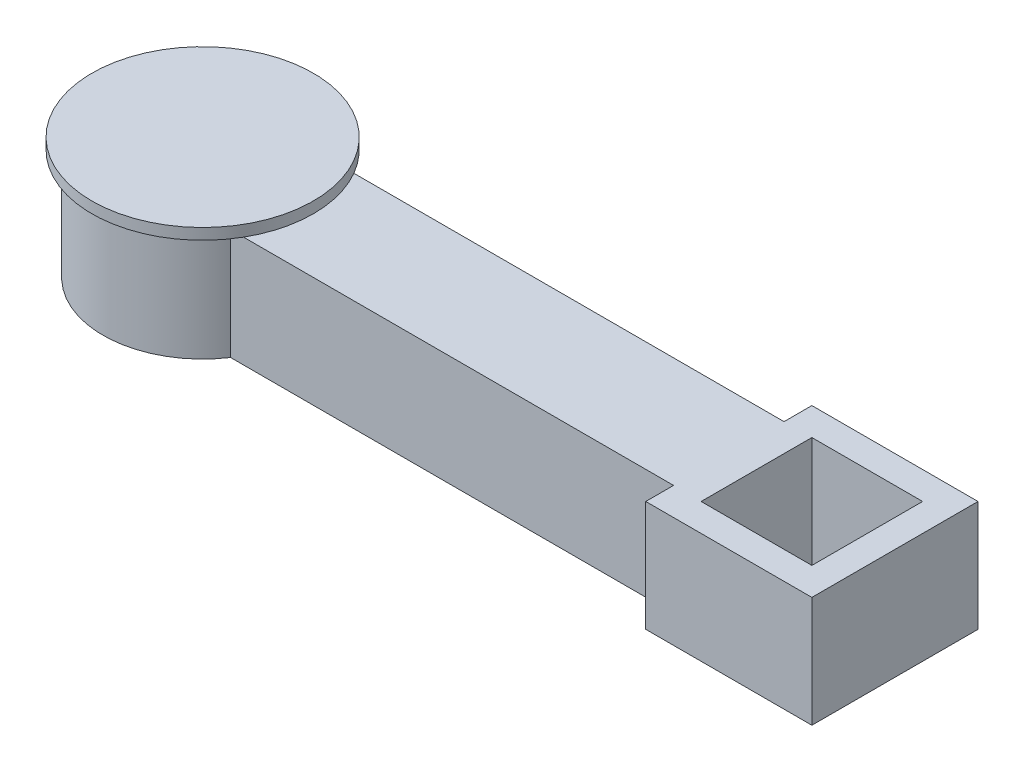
SolidWorks part; units mm, degrees
ref_plane "Front Plane" through (0, 0, 0) normal (0, 0, 1) x (1, 0, 0)
ref_plane "Top Plane" through (0, 0, 0) normal (0, 1, 0) x (1, 0, 0)
ref_plane "Right Plane" through (0, 0, 0) normal (1, 0, 0) x (0, 0, -1)
sketch "Sketch1" plane through (0, 0, 0) normal (0, 1, 0) x (1, 0, 0)
  line L0 (163.1456, 275.7418) -> (163.1456, 275.9924)
  line L1 (163.1456, 175.9924) -> (563.1456, 175.9924)
  line L2 (163.1456, 175.9924) -> (163.1456, 176.2431)
  line L3 (163.1456, 275.9924) -> (563.1456, 275.9924)
  line L4 (563.1456, 175.9924) -> (563.1456, 176.2431)
  line L5 (563.1456, 275.7418) -> (563.1456, 275.9924)
  line L8 (163.1456, 275.9924) -> (563.1456, 275.9924)
  line L9 (163.1456, 275.9924) -> (163.1456, 275.7418)
  line L10 (163.1456, 176.2431) -> (563.1456, 176.2431)
  line L11 (563.1456, 275.9924) -> (563.1456, 176.2431)
  line L12 (563.1456, 301.1178) -> (713.1456, 301.1178)
  line L13 (563.1456, 301.1178) -> (563.1456, 151.1178)
  line L14 (563.1456, 151.1178) -> (713.1456, 151.1178)
  line L15 (713.1456, 301.1178) -> (713.1456, 151.1178)
  arc A0 (163.1456, 275.7418) -> (163.1456, 176.2431) centre (88.1456, 225.9924) ccw
  point P13 (713.1456, 226.1178)
  point P14 (563.1456, 226.1178)
  dimension "D3" = 180
  dimension "D6" = 150
  dimension "D1" = 400
  dimension "D2" = 100
  dimension "D4" = 50
  dimension "D5" = 75
  dimension "D7" = 150
extrude "Boss-Extrude1" add sketch "Sketch1" along normal blind 100 contours L0 A0 L10 L11 L5 L3 | L13 L12 L15 L14
sketch "Sketch5" plane through (0, 100, 0) normal (0, 1, 0) x (1, 0, 0)
  circle A0 centre (88.1456, 225.9924) radius 70
  dimension "D1" = 140
extrude "Cut-Extrude2" cut sketch "Sketch5" against normal blind 100
sketch "Sketch6" plane through (0, 100, 0) normal (0, 1, 0) x (1, 0, 0)
  circle A0 centre (88.1456, 225.9924) radius 100
  dimension "D1" = 200
extrude "Boss-Extrude4" add sketch "Sketch6" along normal blind 10
sketch "Sketch7" plane through (0, 100, 0) normal (0, 1, 0) x (1, 0, 0)
  line L0 (563.1456, 301.1178) -> (713.1456, 301.1178) construction
  line L1 (588.1456, 176.1178) -> (688.1456, 176.1178)
  line L2 (588.1456, 176.1178) -> (588.1456, 276.1178)
  line L3 (588.1456, 276.1178) -> (688.1456, 276.1178)
  line L4 (688.1456, 176.1178) -> (688.1456, 276.1178)
  line L5 (713.1456, 301.1178) -> (713.1456, 151.1178) construction
  point P6 (638.1456, 301.1178)
  point P7 (638.1456, 276.1178)
  point P10 (713.1456, 226.1178)
  point P11 (688.1456, 226.1178)
  dimension "D1" = 100
  dimension "D2" = 100
extrude "Cut-Extrude3" cut sketch "Sketch7" against normal blind 100
